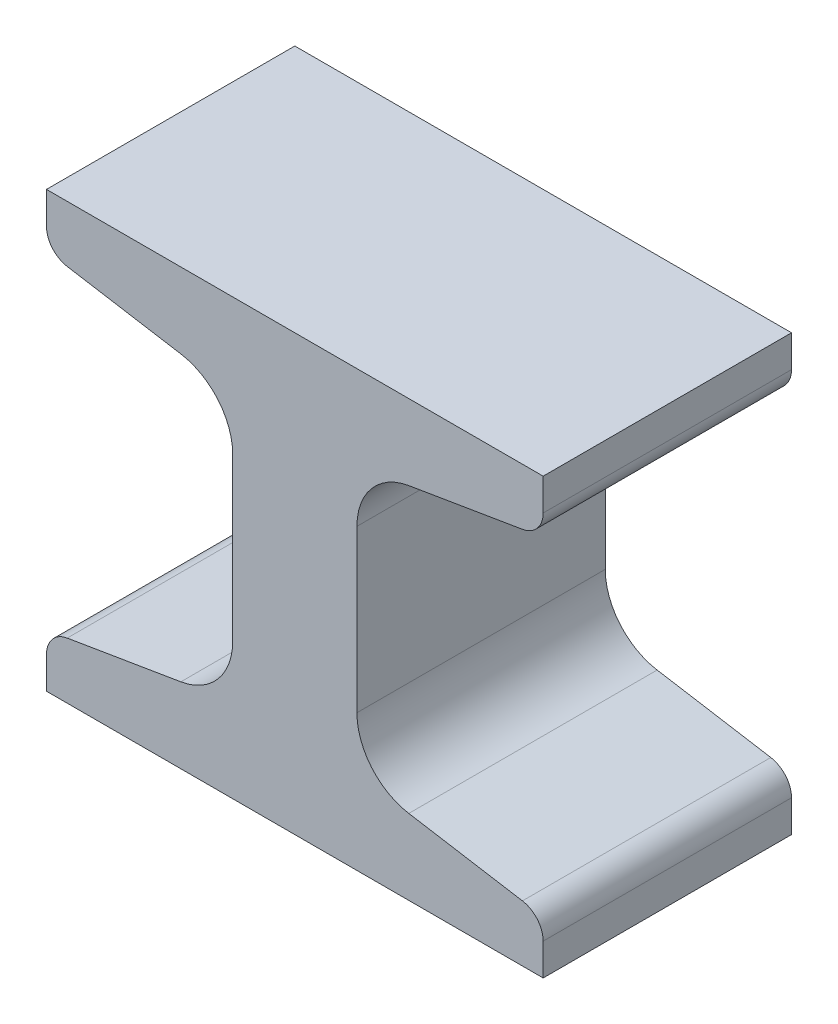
SolidWorks part; units mm, degrees
ref_plane "Plane1" through (0, 0, 0) normal (0, 0, 1) x (1, 0, 0)
ref_plane "Plane2" through (0, 0, 0) normal (0, 1, 0) x (-1, 0, 0)
ref_plane "Plane3" through (0, 0, 0) normal (1, 0, 0) x (0, 0, -1)
other "Configuration Table"
sketch "Sketch1" plane through (0, 0, 0) normal (0, 0, 1) x (1, 0, 0)
  line L0 (0, 0) -> (0, 3.2645)
  line L1 (2.1225, 5.77) -> (13.7437, 7.7064)
  line L2 (19.05, 13.97) -> (19.05, 30.48)
  line L3 (13.7437, 36.7436) -> (2.1225, 38.68)
  line L4 (0, 41.1855) -> (0, 44.45)
  line L5 (0, 44.45) -> (50.8, 44.45)
  line L6 (50.8, 44.45) -> (50.8, 41.1855)
  line L7 (48.6775, 38.68) -> (37.0563, 36.7436)
  line L8 (31.75, 30.48) -> (31.75, 13.97)
  line L9 (37.0563, 7.7064) -> (48.6775, 5.77)
  line L10 (50.8, 3.2645) -> (50.8, 0)
  line L11 (50.8, 0) -> (0, 0)
  line L12 (15.6984, 0) -> (-15.6984, 0) construction
  line L13 (0, -13.7361) -> (0, 13.7361) construction
  arc A0 (13.7437, 7.7064) -> (19.05, 13.97) centre (12.7, 13.97) ccw
  arc A1 (19.05, 30.48) -> (13.7437, 36.7436) centre (12.7, 30.48) ccw
  arc A2 (37.0563, 36.7436) -> (31.75, 30.48) centre (38.1, 30.48) ccw
  arc A3 (31.75, 13.97) -> (37.0563, 7.7064) centre (38.1, 13.97) ccw
  arc A4 (48.6775, 38.68) -> (50.8, 41.1855) centre (48.26, 41.1855) ccw
  arc A5 (2.1225, 38.68) -> (0, 41.1855) centre (2.54, 41.1855) cw
  arc A6 (48.6775, 5.77) -> (50.8, 3.2645) centre (48.26, 3.2645) cw
  arc A7 (2.1225, 5.77) -> (0, 3.2645) centre (2.54, 3.2645) ccw
  dimension "D7" = 9.46
  dimension "RI" = 6.35
  dimension "RA" = 2.54
  dimension "BF" = 50.8
  dimension "D6" = 9.46
  dimension "DEPTH" = 44.45
  dimension "TW" = 12.7
  dimension "D1" = 16.51
extrude "BaseAlumBeam" add sketch "Sketch1" along normal mid plane 25.4
